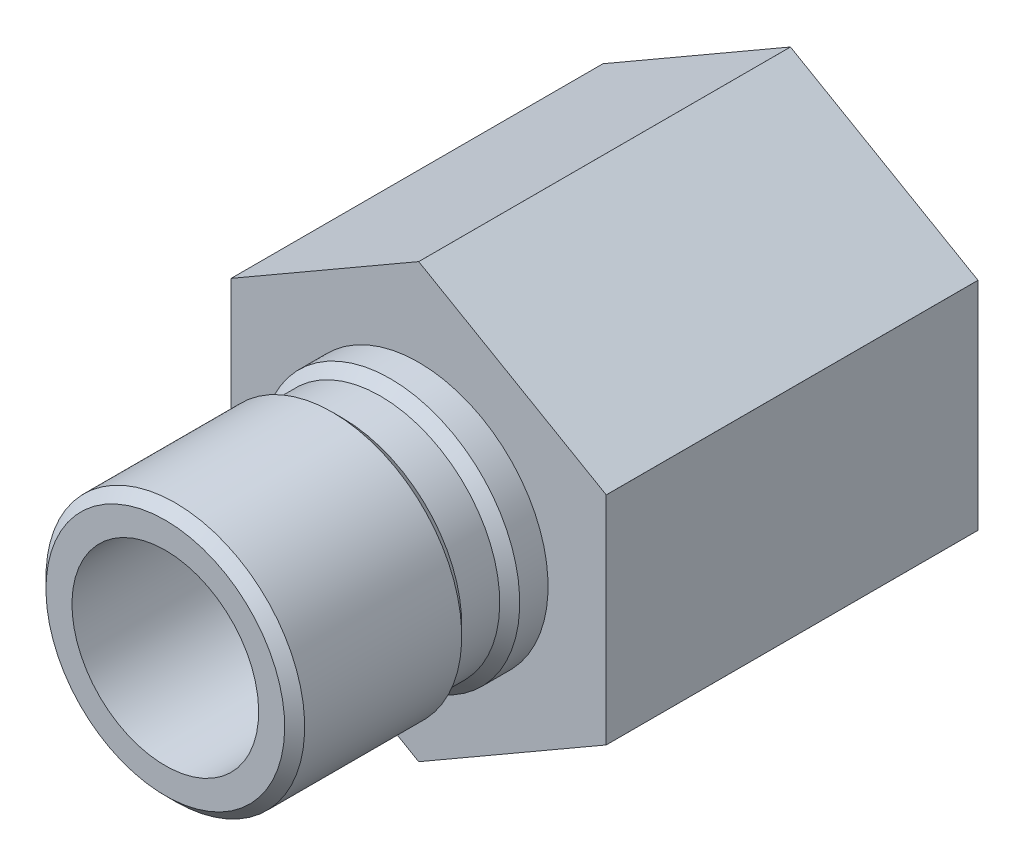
SolidWorks part; units mm, degrees
ref_plane "Front Plane" through (0, 0, 0) normal (0, 0, 1) x (1, 0, 0)
ref_plane "Top Plane" through (0, 0, 0) normal (0, 1, 0) x (1, 0, 0)
ref_plane "Right Plane" through (0, 0, 0) normal (1, 0, 0) x (0, 0, -1)
sketch "Sketch1" plane through (0, 0, 0) normal (1, 0, 0) x (0, 0, -1)
  line L0 (0, 0) -> (-22.479, 0) construction
  line L1 (-19.304, 7.112) -> (-19.304, 9.0932)
  line L2 (-5.8166, 9.0932) -> (-5.8166, 0) construction
  line L3 (-18.542, 9.8552) -> (-6.5786, 9.8552)
  line L4 (0, 16.4973) -> (0, 0) construction
  line L5 (-5.8166, 9.0932) -> (-2.921, 9.0932)
  line L6 (-2.159, 9.8552) -> (0, 9.8552)
  line L7 (0, 9.8552) -> (0, 16.4973)
  line L8 (-5.8166, 9.0932) -> (-6.5786, 9.8552)
  line L9 (-2.921, 9.0932) -> (-2.159, 9.8552)
  line L10 (-19.304, 9.0932) -> (-18.542, 9.8552)
  line L11 (-19.304, 7.112) -> (6.8272, 7.112)
  line L12 (0, 16.4973) -> (28.321, 16.4973)
  line L14 (28.321, 16.4973) -> (28.321, 12.3034)
  line L15 (9.271, 11.7081) -> (28.321, 12.3034)
  line L16 (6.8272, 7.112) -> (9.271, 11.7081)
  dimension "D1" = 19.304
  dimension "D2" = 2.8956
  dimension "D3" = 0.762
  dimension "D4" = 45
  dimension "D5" = 13.4874
  dimension "D6" = 45
  dimension "D7" = 32.9946
  dimension "D8" = 118
  dimension "D9" = 47.625
  dimension "D10" = 3.175
  dimension "D11" = 23.4163
  dimension "D12" = 14.224
  dimension "D13" = 1.79
  dimension "D14" = 19.7104
  dimension "D15" = 19.05
revolve "Revolve1" add sketch "Sketch1" angle 360 about L0
sketch "Sketch2" plane through (0, 0, 0) normal (0, 0, 1) x (1, 0, 0)
  line L1 (-14.2875, 8.2489) -> (-14.2875, -8.2489)
  line L2 (-14.2875, -8.2489) -> (0, -16.4978)
  line L3 (0, -16.4978) -> (14.2875, -8.2489)
  line L4 (14.2875, -8.2489) -> (14.2875, 8.2489)
  line L5 (14.2875, 8.2489) -> (0, 16.4978)
  line L6 (0, 16.4978) -> (-14.2875, 8.2489)
  circle A0 centre (0, 0) radius 14.2875 construction
  dimension "D1" = 28.575
extrude "Cut-Extrude1" cut sketch "Sketch2" against normal through all flip side to cut
